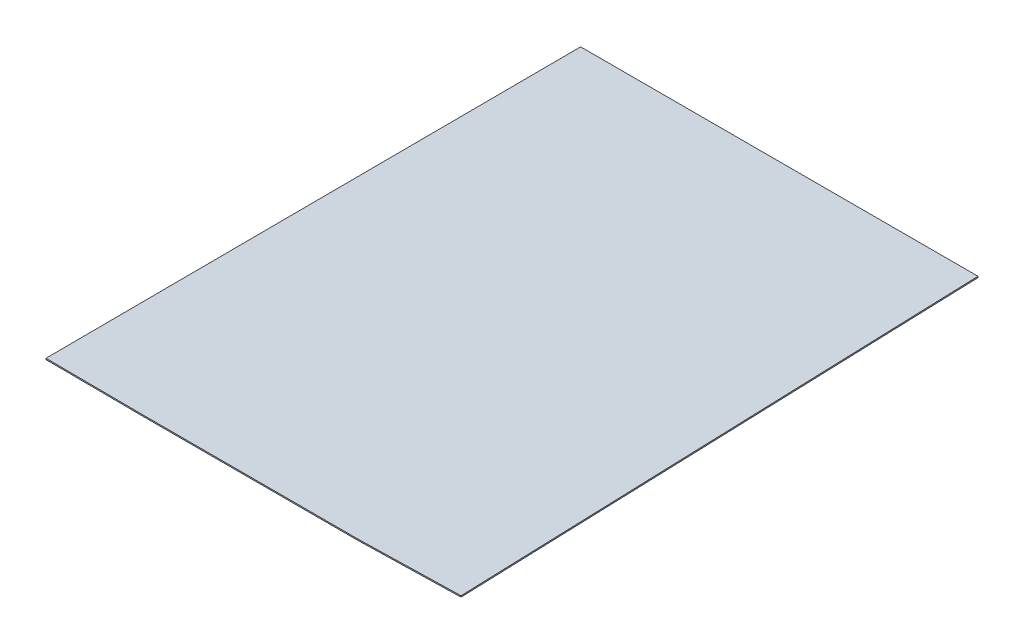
SolidWorks part; units mm, degrees
ref_plane "Vorne" through (0, 0, 0) normal (0, 0, 1) x (1, 0, 0)
ref_plane "Oben" through (0, 0, 0) normal (0, 1, 0) x (1, 0, 0)
ref_plane "Rechts" through (0, 0, 0) normal (1, 0, 0) x (0, 0, -1)
ref_plane "Ebene2" through (0, 0, -385.094) normal (0, 0, 1) x (1, 0, 0)
sketch "Skizze1" plane through (0, 0, -385.094) normal (0, 0, 1) x (1, 0, 0)
  line L0 (-96.1942, 48.6368) -> (-96.1942, -18.3299)
  line L1 (-91.1942, -23.3299) -> (68.8369, -23.3299)
  line L2 (73.8369, -18.3299) -> (73.8369, 51.4048)
  arc A0 (-96.1942, -18.3299) -> (-91.1942, -23.3299) centre (-91.1942, -18.3299) ccw
  arc A1 (68.8369, -23.3299) -> (73.8369, -18.3299) centre (68.8369, -18.3299) ccw
  dimension "D1" = 5
ref_plane "Ebene1" through (0, 0, 358.2549) normal (0, 0, 1) x (1, 0, 0)
sketch "Skizze2" plane through (0, 0, 358.2549) normal (0, 0, 1) x (1, 0, 0)
  line L0 (-93.7081, 47.7865) -> (-93.7081, -25.4792)
  line L1 (-88.7081, -30.4792) -> (79.6502, -30.4792)
  line L2 (84.6502, -25.4792) -> (84.6502, 51.8401)
  arc A0 (-93.7081, -25.4792) -> (-88.7081, -30.4792) centre (-88.7081, -25.4792) ccw
  arc A1 (79.6502, -30.4792) -> (84.6502, -25.4792) centre (79.6502, -25.4792) ccw
  dimension "D1" = 5
sheet metal parameters "Blech1" thickness 1 parameters "D1"=1.6, "Dicke"=1
lofted bend "Ausgeformte Biegungen1" parameters "D1"=0, "D12"=1
other "Freiform-Biegung1" parameters "D1"=1000, "D4"=57.296, "D5"=1
other "Freiform-Biegung2" parameters "D1"=1000, "D4"=57.296, "D5"=2
flat pattern "Abwicklung1"
sketch "Biegung-Linien1" plane through (0, -27.0311, -0.26) normal (0, -1, -0.0096) x (1, 0, 0)
  line L0 (79.6502, 358.5315) -> (68.8369, -384.8518) construction
  line L1 (86.8864, 358.4481) -> (76.0731, -384.9352) construction
  line L2 (-88.7081, 358.5315) -> (-91.1942, -384.8518) construction
  line L3 (-95.9449, 358.4958) -> (-98.431, -384.8874) construction
other "Abwickeln-<Freiform-Biegung1>1"
other "Abwickeln-<Freiform-Biegung2>1"
sketch "Skizze5" plane through (0, -26.0311, -0.2504) normal (0, 1, 0.0096) x (1, 0, 0)
  line L0 (-308.0594, 71.091) -> (258.8149, 71.091)
extrude "Linear austragen1" cut sketch "Skizze5" against normal through all and the other way through all
sketch "Skizze4" plane through (0, -26.0311, -0.2504) normal (0, 1, 0.0096) x (1, 0, 0)
  line L0 (-169.2091, -358.0362) -> (164.1831, -356.5801) construction
  dimension "D1" = 333.3922
